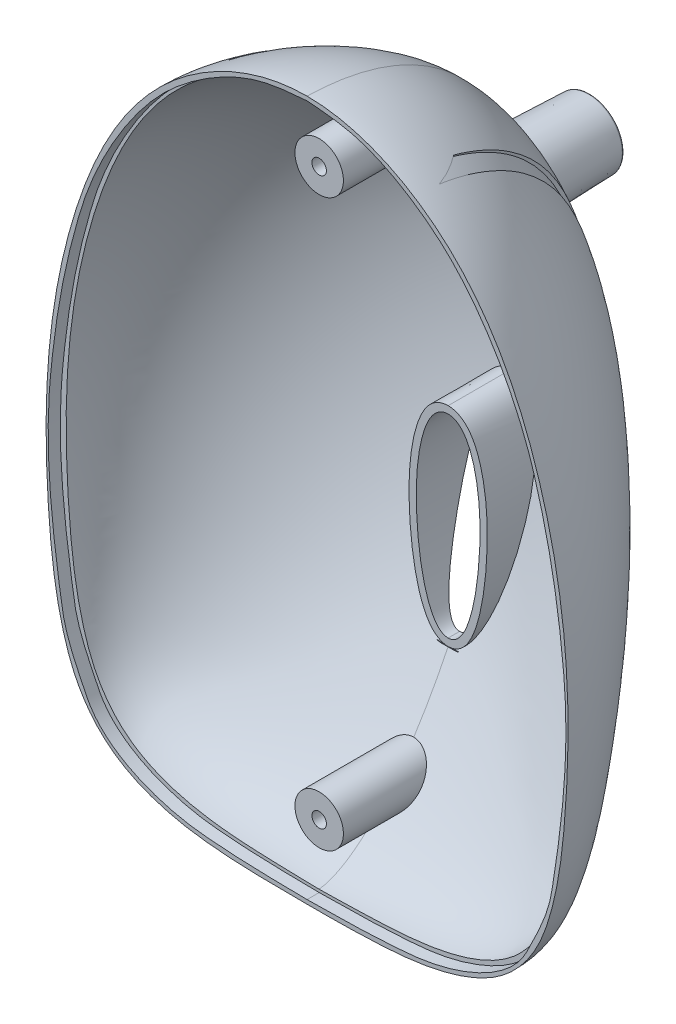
SolidWorks part; units mm, degrees
ref_plane "Plan de face" through (0, 0, 0) normal (0, 0, 1) x (1, 0, 0)
ref_plane "Plan de dessus" through (0, 0, 0) normal (0, 1, 0) x (1, 0, 0)
ref_plane "Plan de droite" through (0, 0, 0) normal (1, 0, 0) x (0, 0, -1)
sketch "Esquisse7" plane through (0, 0, 0) normal (0, 0, 1) x (1, 0, 0)
  line L1 (0, 43.0229) -> (0, -43.0741) construction
  line L2 (8.9926, 43.3015) -> (-8.9926, 43.3015) construction
  line L3 (0, 43.3015) -> (0, -43.3015)
  line L4 (-7.9081, -43.3015) -> (7.9111, -43.3015) construction
  spline S0 degree 3 poles (0, 43.3015) (6.2364, 43.3015) (20.3389, 36.6986) (29.1819, 18.085) (32.5293, -0.7699) (32.3083, -15.8181) (30.9891, -27.1647) (28.4108, -34.4542) (24.3625, -39.3374) (17.6782, -42.2475) (9.5678, -43.2993) (2.8138, -43.3015) (0, -43.3015) knots 0 0 0 0 0.148607 0.342235 0.473839 0.612003 0.704695 0.749032 0.797419 0.853557 0.919652 1 1 1 1
  spline S1 degree 3 poles (0, 43.3015) (1.5717, 43.3015) (3.054, 43.166) (5.8477, 42.6545) (7.1585, 42.2783) (9.6129, 41.3381) (10.7559, 40.7748) (12.3615, 39.8395) (12.8774, 39.5138) (13.8863, 38.8334) (14.3791, 38.478) (16.7852, 36.63) (18.5232, 34.9247) (21.6459, 31.1687) (23.0314, 29.1179) (25.4831, 24.7579) (26.5496, 22.4485) (28.3934, 17.6452) (29.1706, 15.1512) (31.1037, 7.4964) (31.8623, 2.1628) (32.309, -5.7714) (32.3423, -8.4051) (32.2291, -12.2879) (32.1641, -13.5709) (32.0669, -14.9176) (32.0611, -14.9968) (32.0493, -15.155) (32.0431, -15.2348) (32.0257, -15.462) (32.014, -15.6142) (31.979, -16.0727) (31.9555, -16.381) (31.8836, -17.3127) (31.8341, -17.9429) (31.6739, -19.8513) (31.5519, -21.1474) (31.2398, -23.7442) (31.0499, -25.045) (30.5586, -27.6135) (30.2575, -28.8815) (29.4883, -31.3503) (29.0204, -32.5519) (28.1357, -34.2698) (27.8101, -34.8282) (27.2678, -35.6366) (27.0781, -35.9011) (26.6794, -36.4187) (26.4697, -36.6725) (25.3838, -37.8948) (24.3948, -38.727) (22.27, -40.1171) (21.1352, -40.6768) (18.7762, -41.5871) (17.551, -41.9384) (15.0327, -42.4925) (13.7389, -42.6951) (11.0963, -42.9976) (9.7474, -43.0974) (5.6407, -43.2981) (2.8222, -43.3015) (0, -43.3015) knots 0 0 0 0 0.03125 0.03125 0.0625 0.0625 0.09375 0.09375 0.109375 0.109375 0.125 0.125 0.1875 0.1875 0.25 0.25 0.3125 0.3125 0.375 0.375 0.5 0.5 0.5625 0.5625 0.59375 0.59375 0.595703 0.595703 0.597656 0.597656 0.601562 0.601562 0.609375 0.609375 0.625 0.625 0.65625 0.65625 0.6875 0.6875 0.71875 0.71875 0.75 0.75 0.765625 0.765625 0.773438 0.773438 0.78125 0.78125 0.8125 0.8125 0.84375 0.84375 0.875 0.875 0.90625 0.90625 0.9375 0.9375 1 1 1 1 construction
  spline S2 degree 3 poles (0, -43.3015) (-2.8222, -43.3015) (-5.6407, -43.2981) (-9.7474, -43.0974) (-11.0963, -42.9976) (-13.7389, -42.6951) (-15.0327, -42.4925) (-17.551, -41.9384) (-18.7762, -41.5871) (-21.1352, -40.6768) (-22.27, -40.1171) (-24.3948, -38.727) (-25.3838, -37.8948) (-26.4697, -36.6725) (-26.6794, -36.4187) (-27.0781, -35.9011) (-27.2678, -35.6366) (-27.8101, -34.8282) (-28.1357, -34.2698) (-29.0204, -32.5519) (-29.4883, -31.3503) (-30.2575, -28.8815) (-30.5586, -27.6135) (-31.0499, -25.045) (-31.2398, -23.7442) (-31.5519, -21.1474) (-31.6739, -19.8513) (-31.8341, -17.9429) (-31.8836, -17.3127) (-31.9555, -16.381) (-31.979, -16.0727) (-32.014, -15.6142) (-32.0257, -15.462) (-32.0431, -15.2348) (-32.0493, -15.155) (-32.0611, -14.9968) (-32.0669, -14.9176) (-32.1641, -13.5709) (-32.2291, -12.2879) (-32.3423, -8.4051) (-32.309, -5.7714) (-31.8623, 2.1628) (-31.1037, 7.4964) (-29.1706, 15.1512) (-28.3934, 17.6452) (-26.5496, 22.4485) (-25.4831, 24.7579) (-23.0314, 29.1179) (-21.6459, 31.1687) (-18.5232, 34.9247) (-16.7852, 36.63) (-14.3791, 38.478) (-13.8863, 38.8334) (-12.8774, 39.5138) (-12.3615, 39.8395) (-10.7559, 40.7748) (-9.6129, 41.3381) (-7.1585, 42.2783) (-5.8477, 42.6545) (-3.054, 43.166) (-1.5717, 43.3015) (0, 43.3015) knots 0 0 0 0 0.0625 0.0625 0.09375 0.09375 0.125 0.125 0.15625 0.15625 0.1875 0.1875 0.21875 0.21875 0.226562 0.226562 0.234375 0.234375 0.25 0.25 0.28125 0.28125 0.3125 0.3125 0.34375 0.34375 0.375 0.375 0.390625 0.390625 0.398438 0.398438 0.402344 0.402344 0.404297 0.404297 0.40625 0.40625 0.4375 0.4375 0.5 0.5 0.625 0.625 0.6875 0.6875 0.75 0.75 0.8125 0.8125 0.875 0.875 0.890625 0.890625 0.90625 0.90625 0.9375 0.9375 0.96875 0.96875 1 1 1 1 construction
sketch "Esquisse8" plane through (0, 0, 0) normal (1, 0, 0) x (0, 0, -1)
  line L1 (0, 43.3015) -> (0, -43.3015) construction
  line L2 (0, 43.3015) -> (0, -43.3015)
  spline S0 degree 3 poles (0, 43.3015) (16.094, 42.9438) (27.2, 31.899) (27.2, -15.5394) (10.2148, -45.0692) (0, -43.3015) knots 0 0 0 0 0.392035 0.392035 1 1 1 1
  dimension "D1" = 27.2
  dimension "D2" = 30
loft "Lissage3" add profiles "Esquisse8", "Esquisse7"
mirror "Symétrie6" about plane through (0, 0, 0) normal (1, 0, 0) of "Lissage3"
ref_plane "Plan3" through (0, 0, -35) normal (0, 0, 1) x (1, 0, 0)
sketch "Esquisse14" plane through (0, 0, -35) normal (0, 0, 1) x (1, 0, 0)
  line L0 (0, 0) -> (0, -23.5015) construction
  line L1 (0, -43.3771) -> (0, 43.3015) construction
  line L2 (0.9939, 0.4985) -> (-0.9939, 0.4985) construction
  line L3 (-0.894, -23.5015) -> (0.894, -23.5015) construction
  line L4 (-3.95, -18.145) -> (-3.95, -22.5658) construction
  spline S0 degree 3 poles (0, -23.5015) (-2.7526, -23.5015) (-3.95, -15.7482) (-3.95, -5.3994) (-2.9112, 0.4985) (0, 0.4985) knots 0 0 0 0 0.556949 0.556949 1 1 1 1
  spline S1 degree 3 poles (0, -23.5015) (2.7526, -23.5015) (3.95, -15.7482) (3.95, -5.3994) (2.9112, 0.4985) (0, 0.4985) knots 0 0 0 0 0.556949 0.556949 1 1 1 1
  dimension "D1" = 24
  dimension "D2" = 7.9
  dimension "D3" = 19.8
extrude "Enlèv. mat.-Extru.5" cut sketch "Esquisse14" along normal through all
shell "Coque5" thickness 0.9
sketch "Esquisse10" plane through (0, 0, 0) normal (0, 0, 1) x (1, 0, 0)
  circle A0 centre (0, 35) radius 0.8989
  circle A1 centre (0, -35) radius 0.8989
  circle A2 centre (0, 35) radius 3
  circle A3 centre (0, -35) radius 3
  dimension "D2" = 1.7979
  dimension "D3" = 6
  dimension "D4" = 6
  dimension "D1" = 70
  dimension "D5" = 35
extrude "Extrusion1" add sketch "Esquisse10" against normal up to surface (18.4837 mm away)
sketch "Esquisse12" plane through (0, 0, -35) normal (0, 0, 1) x (1, 0, 0)
  line L0 (0, -43.3771) -> (0, -23.5015) construction
  circle A0 centre (0, 21.903) radius 2.5
  circle A1 centre (0, 21.903) radius 4.2
  dimension "D1" = 5
  dimension "D2" = 8.4
extrude "Extrusion2" add sketch "Esquisse12" along normal up to surface draft 2
sketch "Esquisse13" plane through (0, 0, -35) normal (0, 0, 1) x (1, 0, 0)
  line L0 (0, 19.6919) -> (0, 24.0804) construction
  circle A0 centre (0, 21.8862) radius 2.5
extrude "Enlèv. mat.-Extru.3" cut sketch "Esquisse13" along normal through all
fillet "Congé1" radius 0.2 4 edges at (4.2, 21.903, -35) (0, 24.403, -35) (-0.6318, 24.305, -34.533) (0, 19.3862, -35)
ref_plane "Plan4" through (0, 0, -17.459) normal (0, 0, 1) x (1, 0, 0)
sketch "Esquisse15" plane through (0, 0, -17.459) normal (0, 0, 1) x (1, 0, 0)
  line L0 (-4.0957, -22.3164) -> (-2.8531, -23.559)
  line L1 (-4.9744, 3.678) -> (4.8878, 3.678)
  line L2 (-4.9744, 3.678) -> (-4.9744, -20.1951)
  line L3 (-0.7318, -24.4377) -> (0.6452, -24.4377)
  line L4 (4.8878, 3.678) -> (4.8878, -20.1951)
  line L5 (2.7665, -23.559) -> (4.0091, -22.3164)
  arc A0 (2.7665, -23.559) -> (0.6452, -24.4377) centre (0.6452, -21.4377) cw
  arc A1 (-2.8531, -23.559) -> (-0.7318, -24.4377) centre (-0.7318, -21.4377) ccw
  arc A2 (-4.0957, -22.3164) -> (-4.9744, -20.1951) centre (-1.9744, -20.1951) cw
  arc A3 (4.0091, -22.3164) -> (4.8878, -20.1951) centre (1.8878, -20.1951) ccw
  point P1 (4.8878, -24.4377)
  point P2 (-4.9744, -24.4377)
  point P10 (1.8878, -24.4377)
  point P13 (-1.9744, -24.4377)
  point P16 (-4.9744, -21.4377)
  point P19 (4.8878, -21.4377)
  dimension "D1" = 3
  dimension "D3" = 3
  dimension "D4" = 3
extrude "Enlèv. mat.-Extru.6" cut sketch "Esquisse15" along normal through all
sketch "Esquisse16" plane through (0, 0, -35) normal (0, 0, 1) x (1, 0, 0)
  line L0 (0, 43.3015) -> (0, -43.0821) construction
  line L1 (0, -43.3771) -> (0, -23.5015) construction
  line L2 (0, 0.4985) -> (0, 17.424) construction
  spline S0 degree 3 poles (-13.2069, 38.8939) (-12.4919, 33.0674) (-10.2172, 14.5324) (-29.3767, -4.8006) (-28.0835, -38.8881) (-11.5859, -39.4954) (-3.8052, -39.7819) knots 0 0 0 0 0.174654 0.5556 0.790412 1 1 1 1
  spline S2 degree 3 poles (0, 7.6835) (-5.8382, 7.6835) (-7.6435, -17.3503) (-5.2599, -31.2802) (-3.8052, -39.7819) knots 0 0 0 0 0.389689 1 1 1 1
  spline S6 degree 3 poles (13.2069, 38.8939) (12.4919, 33.0674) (10.2172, 14.5324) (29.3767, -4.8006) (28.0835, -38.8881) (11.5859, -39.4954) (3.8052, -39.7819) knots 0 0 0 0 0.174654 0.5556 0.790412 1 1 1 1
  spline S7 degree 3 poles (0, 7.6835) (5.8382, 7.6835) (7.6435, -17.3503) (5.2599, -31.2802) (3.8052, -39.7819) knots 0 0 0 0 0.389689 1 1 1 1
extrude "Enlèv. de mat.-Extru.-Mince7" cut sketch "Esquisse16" along normal offset from surface (8.3873 mm away) 0.5 thin
sketch "Esquisse17" plane through (0, 0, 0) normal (0, 0, 1) x (1, 0, 0)
  line L0 (0, 43.3015) -> (0, 40.5385) construction
  line L1 (0, -42.8) -> (0, 54.2381) construction
  spline S0 degree 3 poles (0, 42.7954) (2.0377, 42.6346) (8.295, 42.1411) (14.4573, 37.8474) (21.4958, 31.2944) (25.8853, 24.1441) (30.075, 10.2478) (31.1688, 3.8947) (32.5116, -11.0053) (31.5671, -18.8659) (29.8147, -29.6783) (28.3978, -32.3677) (24.9604, -39.3108) (18.3486, -41.6992) (8.9079, -42.6957) (4.454, -42.7478) (0, -42.8) knots 0 0 0 0 0.050472 0.154992 0.154992 0.330108 0.330108 0.496318 0.496318 0.692256 0.692256 0.76213 0.76213 0.891873 0.891873 1 1 1 1
  spline S1 degree 3 poles (0, 43.0229) (5.2234, 43.1578) (19.1404, 37.576) (29.3927, 18.2976) (32.1582, -1.6269) (31.7714, -16.286) (30.9271, -27.0644) (28.3011, -34.2264) (24.4389, -39.1319) (17.0477, -42.363) (8.6029, -42.9849) (2.6221, -43.0469) (0, -43.0741) knots 0 0 0 0 0.119395 0.350243 0.48498 0.610555 0.706865 0.745962 0.795055 0.854209 0.936081 1 1 1 1 construction
  spline S3 degree 3 poles (0, 42.7954) (-2.0377, 42.6346) (-8.295, 42.1411) (-14.4573, 37.8474) (-21.4958, 31.2944) (-25.8853, 24.1441) (-30.075, 10.2478) (-31.1688, 3.8947) (-32.5116, -11.0053) (-31.5671, -18.8659) (-29.8147, -29.6783) (-28.3978, -32.3677) (-24.9604, -39.3108) (-18.3486, -41.6992) (-8.9079, -42.6957) (-4.454, -42.7478) (0, -42.8) knots 0 0 0 0 0.050472 0.154992 0.154992 0.330108 0.330108 0.496318 0.496318 0.692256 0.692256 0.76213 0.76213 0.891873 0.891873 1 1 1 1
extrude "Enlèv. mat.-Extru.7" cut sketch "Esquisse17" against normal blind 1.5
